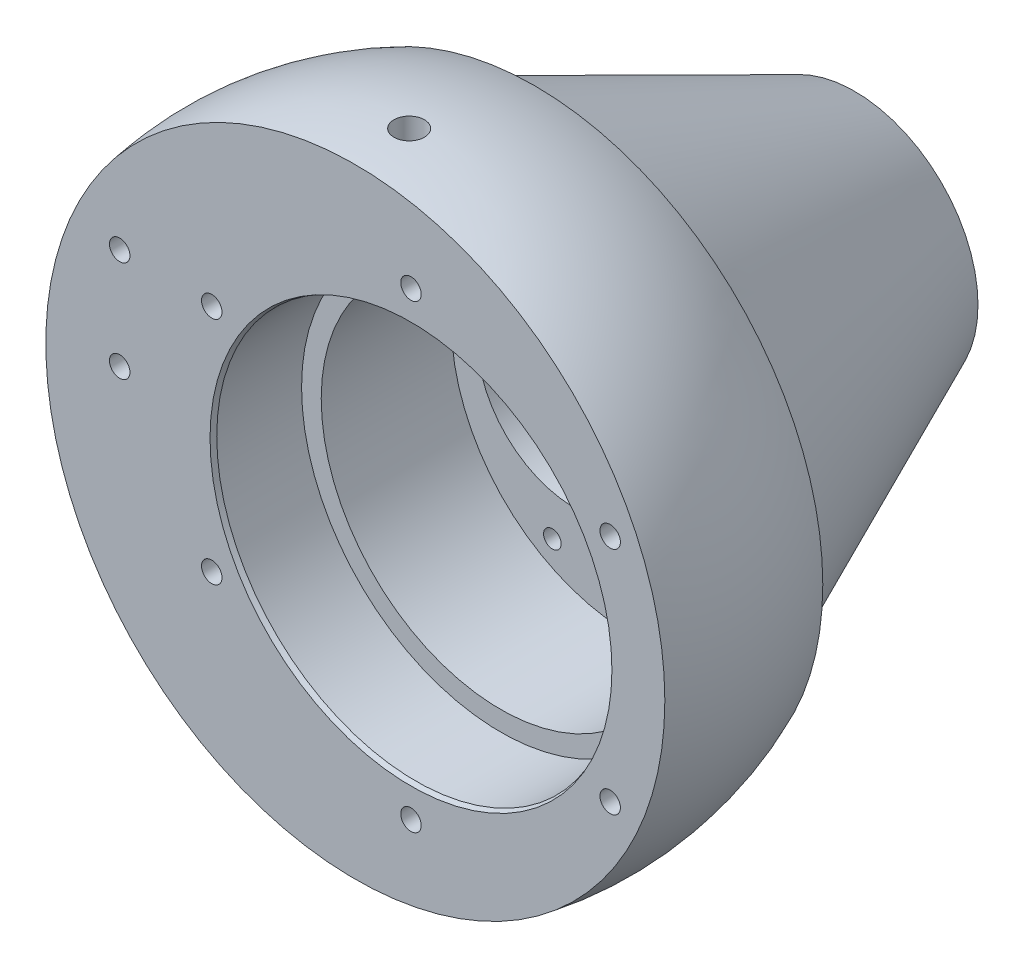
SolidWorks part; units mm, degrees
ref_plane "FRONT" through (0, 0, 0) normal (0, 0, 1) x (1, 0, 0)
ref_plane "TOP" through (0, 0, 0) normal (0, 1, 0) x (1, 0, 0)
ref_plane "RIGHT SIDE" through (0, 0, 0) normal (1, 0, 0) x (0, 0, -1)
sketch "Sketch2" plane through (0, 0, 0) normal (1, 0, 0) x (0, 0, -1)
  line L0 (0, 0) -> (154.94, 0) construction
  line L1 (0, 27.7812) -> (0, 87.584)
  line L2 (151.5872, 10.3124) -> (151.5872, 30.3174)
  line L3 (50.8, 75.184) -> (50.8, 81.4782)
  line L4 (135.7122, 10.9982) -> (128.6002, 10.9982)
  line L5 (128.6002, 27.7812) -> (0, 27.7812)
  line L6 (15.24, 93.98) -> (15.24, 0) construction
  line L7 (128.6002, 10.9982) -> (128.6002, 27.7812)
  line L8 (151.5872, 30.3174) -> (50.8, 75.184)
  line L9 (135.7122, 10.9982) -> (135.7122, 6.3754)
  line L10 (135.7122, 6.3754) -> (139.7, 6.3754)
  line L11 (139.7, 6.3754) -> (139.7, 9.525)
  line L12 (139.7, 9.525) -> (144.6022, 9.525)
  line L13 (148.9456, 10.3124) -> (151.5872, 10.3124)
  line L14 (144.6022, 9.525) -> (146.7656, 10.3124)
  line L15 (148.9456, 10.3124) -> (148.9456, 10.9474)
  line L16 (148.9456, 10.9474) -> (147.7772, 10.9474)
  line L17 (147.7772, 10.9474) -> (147.7772, 10.3124)
  line L19 (147.7772, 10.3124) -> (146.7656, 10.3124)
  arc A1 (50.8, 81.4782) -> (0, 87.584) centre (15.24, 0) ccw
  dimension "D6" = 88.9
  dimension "D20" = 15.24
  dimension "D1" = 113.997
  dimension "D2" = 27.7812
  dimension "D3" = 50.8
  dimension "D4" = 151.5872
  dimension "D5" = 75.184
  dimension "D7" = 15.24
  dimension "D8" = 128.6002
  dimension "D9" = 10.9982
  dimension "D10" = 7.112
  dimension "D11" = 6.3754
  dimension "D12" = 11.8872
  dimension "D13" = 9.525
  dimension "D14" = 10.9474
  dimension "D15" = 20
  dimension "D16" = 4.9022
  dimension "D17" = 10.3124
  dimension "D18" = 3.81
  dimension "D19" = 1.1684
revolve "Base-Revolve" add sketch "Sketch2" angle 360 about L0
sketch "Sketch3" plane through (0, 0, 0) normal (0, 0, 1) x (1, 0, 0)
  line L0 (0, 0) -> (15.748, 0) construction
  circle A0 centre (15.748, 0) radius 50.8
  point P11 (0, 60.96)
  point P13 (-52.07, 0)
  point P14 (52.07, 0)
  dimension "D1" = 101.6
  dimension "D3" = 15.748
extrude "Eccentric" cut sketch "Sketch3" against normal blind 62.23
ref_plane "Plane1" through (0, 0, -166.37) normal (0, 0, 1) x (1, 0, 0)
ref_plane "Plane2" through (0, 88.9, 0) normal (0, 1, 0) x (-1, 0, 0)
ref_plane "Plane3" through (88.9, 0, 0) normal (1, 0, 0) x (0, 0, -1)
sketch "Sketch22" plane through (0, 0, 0) normal (0, 0, 1) x (1, 0, 0)
  line L0 (0, 0) -> (70.7006, 0) construction
  circle A4 centre (-66.675, 33.3375) radius 2.8956
  circle A5 centre (-66.675, 4.7625) radius 2.8956
  dimension "D2" = 4.7625
  dimension "D3" = 28.575
  dimension "D4" = 66.675
  dimension "D1" = 66.675
  dimension "D5" = 5.7912
extrude "ClevisHls#8-32Yardley Triserts" cut sketch "Sketch22" against normal blind 10.16
sketch "Sketch23" plane through (0, 88.9, 0) normal (0, 1, 0) x (-1, 0, 0)
  line L0 (0, 0) -> (0, -154.94) construction
  line L1 (87.584, 0) -> (-87.584, 0) construction
  circle A0 centre (0, -15.24) radius 4.3053
  dimension "D1" = 15.24
  dimension "D2" = 8.6106
extrude ".25-20 Yardley Triserts" cut sketch "Sketch23" against normal blind 15.24
mirror "Mirror1" about plane through (0, 0, 0) normal (0, 1, 0) of ".25-20 Yardley Triserts"
sketch "Sketch24" plane through (0, 0, 0) normal (0, 0, 1) x (1, 0, 0)
  circle A0 centre (15.748, 0) radius 50.8 construction
  circle A1 centre (15.748, 0) radius 50.8
  circle A2 centre (15.748, 0) radius 56.3563
  dimension "D1" = 5.5563
extrude "Cut-Extrude3" cut sketch "Sketch24" against normal blind 25.4
chamfer "Chamfer2" distance 0.508 angle 70 1 edges at (72.1043, 0, 0)
sketch "Sketch25" plane through (0, 0, 0) normal (0, 0, 1) x (1, 0, 0)
  line L0 (15.748, 0) -> (72.1154, 32.5438) construction
  line L1 (15.748, 0) -> (72.1154, -32.5437) construction
  line L2 (15.748, 0) -> (15.748, 65.0875) construction
  line L3 (0, 0) -> (15.748, 0) construction
  line L4 (15.748, 0) -> (15.748, -65.0875) construction
  line L5 (15.748, 0) -> (-40.6194, -32.5438) construction
  line L6 (15.748, 0) -> (-40.6194, 32.5437) construction
  circle A12 centre (72.1154, -32.5437) radius 2.8956
  circle A13 centre (15.748, -65.0875) radius 2.8956
  circle A14 centre (-40.6194, -32.5438) radius 2.8956
  circle A15 centre (-40.6194, 32.5437) radius 2.8956
  circle A16 centre (15.748, 65.0875) radius 2.8956
  circle A17 centre (72.1154, 32.5438) radius 2.8956
  point P1 (15.748, 0)
  dimension "D1" = 15.748
  dimension "D2" = 60
  dimension "D3" = 60
  dimension "D4" = 5.7912
  dimension "D5" = 60
  dimension "D6" = 60
  dimension "D8" = 65.0875
  dimension "D11" = 65.0875
  dimension "D7" = 65.0875
  dimension "D9" = 65.0875
  dimension "D10" = 65.0875
  dimension "D12" = 65.0875
extrude "MotorHsgHls#8-32Yardley Triserts" cut sketch "Sketch25" against normal blind 10.16
sketch "Sketch26" plane through (0, 0, -62.23) normal (0, 0, 1) x (1, 0, 0)
  line L0 (0, 0) -> (60.198, 0) construction
  line L1 (15.748, 0) -> (37.973, 38.4948) construction
  line L2 (15.748, 0) -> (15.748, 79.9418) construction
  line L3 (15.748, 0) -> (-6.477, 38.4948) construction
  line L4 (15.748, 0) -> (-6.477, -38.4948) construction
  line L5 (15.748, 0) -> (37.973, -38.4948) construction
  circle A0 centre (0, 0) radius 81.4782 construction
  circle A1 centre (37.973, -38.4948) radius 2.4892
  circle A2 centre (37.973, 38.4948) radius 2.4892
  circle A6 centre (-6.477, -38.4948) radius 2.4892
  circle A7 centre (60.198, 0) radius 2.4892
  circle A8 centre (-6.477, 38.4948) radius 2.4892
  dimension "D1" = 4.9784
  dimension "D7" = 44.45
  dimension "D2" = 60
  dimension "D3" = 60
  dimension "D4" = 60
  dimension "D5" = 60
  dimension "D6" = 15.748
  dimension "D8" = 44.45
  dimension "D9" = 60.198
extrude "MotorPlt#6-32Yardley Triserts" cut sketch "Sketch26" against normal blind 8.636
chamfer "Chamfer3" distance 0.762 angle 45 1 edges at (10.3124, 0, -151.5872)
sketch "Sketch27" plane through (0, 0, 0) normal (1, 0, 0) x (0, 0, -1)
  line L1 (192.1002, 63.5) -> (141.3002, 63.5)
  line L2 (192.1002, 63.5) -> (192.1002, -63.5)
  line L3 (192.1002, -63.5) -> (141.3002, -63.5)
  line L4 (141.3002, 63.5) -> (141.3002, -63.5)
  point P4 (192.1002, 0)
  dimension "D1" = 127
  dimension "D2" = 50.8
  dimension "D3" = 141.3002
extrude "Cut-Extrude4" cut sketch "Sketch27" against normal through all and the other way through all
sketch "Sketch28" plane through (0, 0, -141.3002) normal (0, 0, -1) x (-1, 0, 0)
  circle A0 centre (0, 0) radius 20.675
  dimension "D1" = 41.35
extrude "Cut-Extrude5" cut sketch "Sketch28" against normal through all
chamfer "Chamfer4" distance 1.016 angle 45 1 edges at (-20.675, 0, -141.3002)
hole_wizard "SealHsg#8-32YardleyShort" positions "Sketch30" profile "Sketch29" hole size "#97" standard "Ansi Inch"
sketch "Sketch30" plane through (0, 0, -141.3002) normal (0, 0, -1) x (-1, 0, 0)
  point P0 (0, 25.4)
  dimension "D1" = 25.4
sketch "Sketch29" plane through (0, 25.4, -141.3002) normal (1, 0, 0) x (0, 1, 0)
  line L0 (0, 0) -> (0, 9.6779)
  line L1 (0, 9.6779) -> (2.8956, 7.938)
  line L2 (2.8956, 7.938) -> (2.8956, 0)
  line L5 (2.8956, 0) -> (0, 0)
  line L10 (0, 9.6779) -> (-2.8956, 7.938) construction
  line L11 (0, -6.35) -> (0, 107.95) construction
  dimension "Hole Dia." = 5.7912
  dimension "Hole Depth" = 7.938
  dimension "Drill Angle" = 118
pattern_circular "CirPattern1" count 6 over 360 about axis through (0, 0, 0) along (0, 0, 1) of "SealHsg#8-32YardleyShort"
